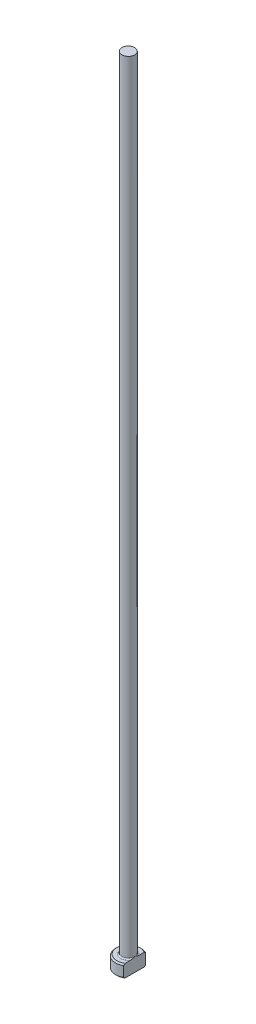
SolidWorks part; units mm, degrees
ref_plane "Front Plane" through (0, 0, 0) normal (0, 0, 1) x (1, 0, 0)
ref_plane "Top Plane" through (0, 0, 0) normal (0, 1, 0) x (1, 0, 0)
ref_plane "Right Plane" through (0, 0, 0) normal (1, 0, 0) x (0, 0, -1)
sketch "Sketch1" plane through (0, 0, 0) normal (0, 0, 1) x (1, 0, 0)
  line L0 (0, 259.9588) -> (0, -15.1925) construction
  line L1 (0, 0) -> (-2, 0)
  line L2 (-2, 0) -> (-2, 2)
  line L3 (-2, 2) -> (-1, 2)
  line L4 (-1, 2) -> (-1, 125)
  line L5 (-1, 125) -> (0, 125)
  line L6 (0, 125) -> (0, 0)
  dimension "L" = 125
  dimension "H" = 4
  dimension "T" = 2
  dimension "D" = 2
revolve "Revolve1" add sketch "Sketch1" angle 360 about L0
chamfer "Chamfer1" distance 0.2 angle 45 2 edges at (0, 2, 2) (0, 0, 2)
fillet "Fillet1" radius 0.2 1 edges at (0, 2, 1)
sketch "Sketch2" plane through (0, 0, 0) normal (0, 1, 0) x (1, 0, 0)
  line L0 (1, 1.7321) -> (1, -1.7321)
  circle A0 centre (0, 0) radius 2 construction
  arc A1 (1, -1.7321) -> (1, 1.7321) centre (0, 0) ccw
  circle A2 centre (0, 0) radius 1 construction
extrude "KEY" cut sketch "Sketch2" along normal through all
